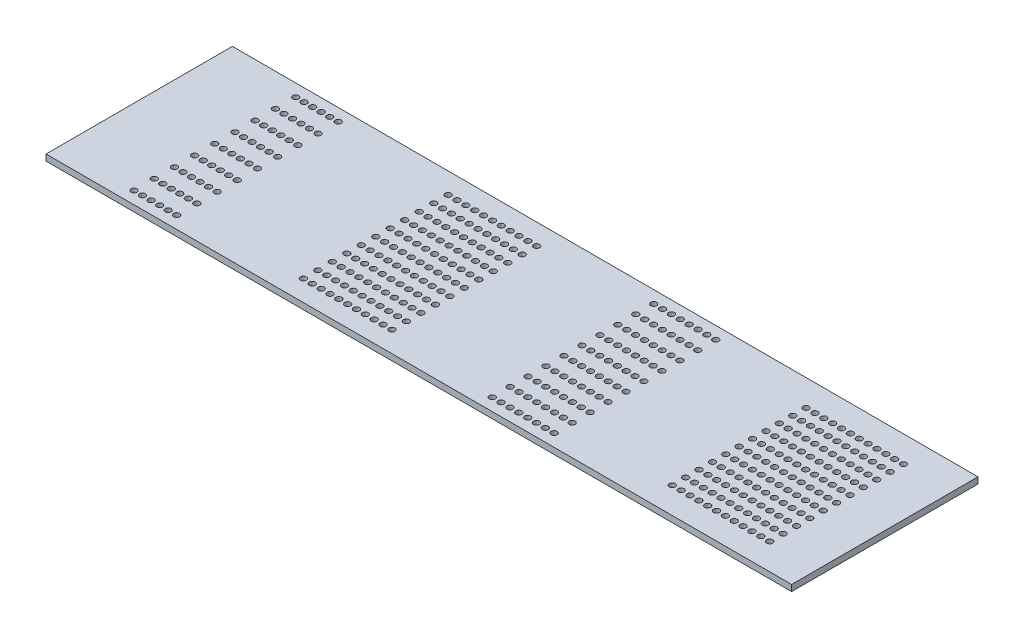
SolidWorks part; units mm, degrees
ref_plane "Plan de face" through (0, 0, 0) normal (0, 0, 1) x (1, 0, 0)
ref_plane "Plan de dessus" through (0, 0, 0) normal (0, 1, 0) x (1, 0, 0)
ref_plane "Plan de droite" through (0, 0, 0) normal (1, 0, 0) x (0, 0, -1)
sketch "Esquisse2" plane through (0, 0, 0) normal (0, 1, 0) x (1, 0, 0)
  line L1 (-60, -15) -> (60, -15)
  line L2 (-60, -15) -> (-60, 15)
  line L3 (-60, 15) -> (60, 15)
  line L4 (60, -15) -> (60, 15)
  line L5 (-60, -15) -> (60, 15) construction
  line L6 (-60, 15) -> (60, -15) construction
  point P0 (0, 0)
  dimension "D1" = 30
  dimension "D2" = 120
extrude "Boss.-Extru.1" add sketch "Esquisse2" along normal blind 1 contours L3 L4 L1 L2
sketch "Cavités" plane through (0, 0, 0) normal (0, 1, 0) x (1, 0, 0)
  line L0 (-60, -15) -> (60, -15) construction
  line L1 (-58.4, 15) -> (-30.4, 15) construction
  line L2 (-58.4, 15) -> (-58.4, -15) construction
  line L3 (-58.4, -15) -> (-30.4, -15) construction
  line L4 (-30.4, 15) -> (-30.4, -15) construction
  line L5 (-60, 15) -> (60, 15) construction
  line L6 (-28.8, 15) -> (-0.8, 15) construction
  line L7 (-28.8, 15) -> (-28.8, -15) construction
  line L8 (-28.8, -15) -> (-0.8, -15) construction
  line L9 (-0.8, 15) -> (-0.8, -15) construction
  line L10 (-30.4, 15) -> (-28.8, 15) construction
  line L11 (0.8, 15) -> (28.8, 15) construction
  line L12 (0.8, 15) -> (0.8, -15) construction
  line L13 (0.8, -15) -> (28.8, -15) construction
  line L14 (28.8, 15) -> (28.8, -15) construction
  line L15 (30.4, 15) -> (58.4, 15) construction
  line L16 (30.4, 15) -> (30.4, -15) construction
  line L17 (30.4, -15) -> (58.4, -15) construction
  line L18 (58.4, 15) -> (58.4, -15) construction
  line L19 (-0.8, 15) -> (0.8, 15) construction
  line L20 (28.8, 15) -> (30.4, 15) construction
  line L21 (-60, 15) -> (-58.4, 15) construction
  line L22 (58.4, 15) -> (60, 15) construction
  dimension "D1" = 28
  dimension "D2" = 1.6
sketch "Esquisse7" plane through (0, 1, 0) normal (0, 1, 0) x (1, 0, 0)
  line L0 (-58.4, 0) -> (-47.83, 0) construction
  line L1 (-47.83, 13) -> (-40.97, 13) construction
  line L2 (-47.83, 13) -> (-47.83, -13) construction
  line L3 (-47.83, -13) -> (-40.97, -13) construction
  line L4 (-40.97, 13) -> (-40.97, -13) construction
  line L5 (-58.4, 15) -> (-58.4, -15) construction
  line L6 (-40.97, 0) -> (-30.4, 0) construction
  line L7 (-30.4, 15) -> (-30.4, -15) construction
  dimension "D1" = 6.86
  dimension "D2" = 26
sketch "Esquisse8" plane through (0, 1, 0) normal (0, 1, 0) x (1, 0, 0)
  circle A0 centre (-47.83, 13) radius 0.475
  dimension "D1" = 0.95
extrude "Enlèv. mat.-Extru.3" cut sketch "Esquisse8" against normal up to next
pattern_linear "Répétition linéaire4" count 6 spacing 1.372 along (1, 0, 0) count 9 spacing 3.25 along (0, 0, 1) of "Enlèv. mat.-Extru.3"
sketch "Esquisse9" plane through (0, 1, 0) normal (0, 1, 0) x (1, 0, 0)
  line L0 (-28.8, 0) -> (-21.925, 0) construction
  line L1 (-21.925, 11.65) -> (-7.675, 11.65) construction
  line L2 (-21.925, 11.65) -> (-21.925, -11.65) construction
  line L3 (-21.925, -11.65) -> (-7.675, -11.65) construction
  line L4 (-7.675, 11.65) -> (-7.675, -11.65) construction
  line L5 (-28.8, 15) -> (-28.8, -15) construction
  line L6 (-7.675, 0) -> (-0.8, 0) construction
  line L7 (-0.8, 15) -> (-0.8, -15) construction
  dimension "D1" = 14.25
  dimension "D2" = 23.3
sketch "Esquisse10" plane through (0, 1, 0) normal (0, 1, 0) x (1, 0, 0)
  circle A0 centre (-21.925, 11.65) radius 0.475
  dimension "D1" = 0.95
extrude "Enlèv. mat.-Extru.4" cut sketch "Esquisse10" against normal up to next
pattern_linear "Répétition linéaire5" count 11 spacing 1.425 along (1, 0, 0) count 11 spacing 2.33 along (0, 0, 1) of "Enlèv. mat.-Extru.4"
sketch "Esquisse11" plane through (0, 1, 0) normal (0, 1, 0) x (1, 0, 0)
  line L0 (0.8, 0) -> (9.8125, 0) construction
  line L1 (9.8125, 13) -> (19.7875, 13) construction
  line L2 (9.8125, 13) -> (9.8125, -13) construction
  line L3 (9.8125, -13) -> (19.7875, -13) construction
  line L4 (19.7875, 13) -> (19.7875, -13) construction
  line L5 (0.8, 15) -> (0.8, -15) construction
  line L6 (19.7875, 0) -> (28.8, 0) construction
  line L7 (28.8, 15) -> (28.8, -15) construction
  dimension "D1" = 9.975
  dimension "D2" = 26
sketch "Esquisse12" plane through (0, 1, 0) normal (0, 1, 0) x (1, 0, 0)
  circle A0 centre (9.8125, 13) radius 0.475
  dimension "D1" = 0.95
extrude "Enlèv. mat.-Extru.5" cut sketch "Esquisse12" against normal up to next
pattern_linear "Répétition linéaire6" count 8 spacing 1.425 along (1, 0, 0) count 10 spacing 2.8889 along (0, 0, 1) of "Enlèv. mat.-Extru.5"
sketch "Esquisse13" plane through (0, 1, 0) normal (0, 1, 0) x (1, 0, 0)
  line L0 (30.4, 0) -> (36.5625, 0) construction
  line L1 (36.5625, 10.77) -> (52.2375, 10.77) construction
  line L2 (36.5625, 10.77) -> (36.5625, -10.77) construction
  line L3 (36.5625, -10.77) -> (52.2375, -10.77) construction
  line L4 (52.2375, 10.77) -> (52.2375, -10.77) construction
  line L5 (30.4, 15) -> (30.4, -15) construction
  line L6 (52.2375, 0) -> (58.4, 0) construction
  line L7 (58.4, 15) -> (58.4, -15) construction
  dimension "D1" = 21.54
  dimension "D2" = 15.675
sketch "Esquisse14" plane through (0, 1, 0) normal (0, 1, 0) x (1, 0, 0)
  circle A0 centre (36.5625, 10.77) radius 0.475
  dimension "D1" = 0.95
extrude "Enlèv. mat.-Extru.6" cut sketch "Esquisse14" against normal up to next
pattern_linear "Répétition linéaire7" count 12 spacing 1.425 along (1, 0, 0) count 11 spacing 2.154 along (0, 0, 1) of "Enlèv. mat.-Extru.6"
